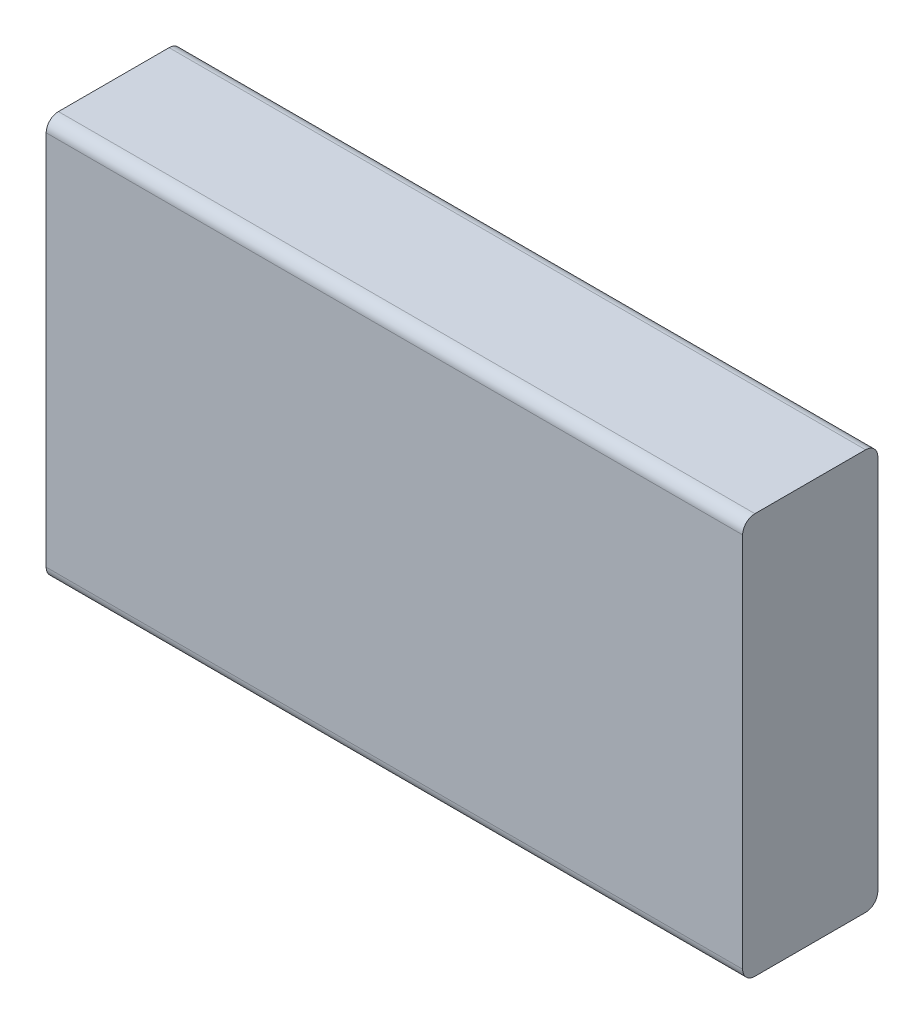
SolidWorks part; units mm, degrees
ref_plane "Front" through (0, 0, 0) normal (0, 0, 1) x (1, 0, 0)
ref_plane "Top" through (0, 0, 0) normal (0, 1, 0) x (1, 0, 0)
ref_plane "Right" through (0, 0, 0) normal (1, 0, 0) x (0, 0, -1)
sketch "Sketch1" plane through (0, 0, 0) normal (0, 0, 1) x (1, 0, 0)
  line L1 (0, 0) -> (144.272, 0)
  line L2 (0, 0) -> (0, -83)
  line L3 (0, -83) -> (144.272, -83)
  line L4 (144.272, 0) -> (144.272, -83)
  dimension "D1" = 144.272
  dimension "D2" = 83
extrude "Boss-Extrude1" add sketch "Sketch1" along normal blind 28
sketch "Sketch2" plane through (0, 0, 0) normal (-1, 0, 0) x (0, 0, 1)
  line L0 (28, 0) -> (0, 0) construction
  line L7 (10.19, -11.4281) -> (17.81, -11.4281)
  line L10 (10.19, -11.4281) -> (10.19, -13.9681)
  line L11 (10.19, -13.9681) -> (17.81, -13.9681)
  line L12 (17.81, -11.4281) -> (17.81, -13.9681)
  circle A0 centre (14.171, -59.8135) radius 1.5019
  point P6 (18.3292, -18.318)
  point P9 (14, 0)
  point P10 (14, -13.9681)
  dimension "D1" = 2.54
  dimension "D2" = 7.62
extrude "Cut-Extrude1" cut sketch "Sketch2" against normal blind 85.09
fillet "Fillet1" radius 2.54 4 edges at (72.136, 0, 0) (72.136, 0, 28) (72.136, -83, 0) (72.136, -83, 28)
